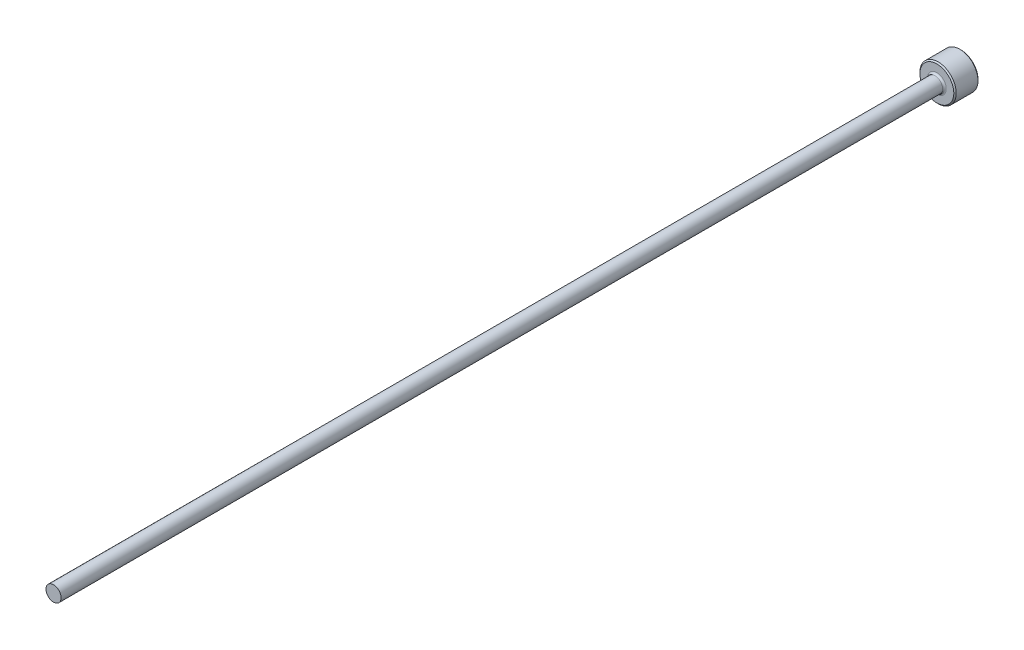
SolidWorks part; units mm, degrees
ref_plane "Front Plane" through (0, 0, 0) normal (0, 0, 1) x (1, 0, 0)
ref_plane "Top Plane" through (0, 0, 0) normal (0, 1, 0) x (1, 0, 0)
ref_plane "Right Plane" through (0, 0, 0) normal (1, 0, 0) x (0, 0, -1)
sketch "Sketch1" plane through (0, 0, 0) normal (1, 0, 0) x (0, 0, -1)
  line L0 (0, 0) -> (0, 3)
  line L1 (0, 3.3) -> (0, -3.3) construction
  line L2 (0, 3) -> (-4, 3)
  line L3 (-4, 3) -> (-4, 1.55)
  line L4 (-4.3, 1.25) -> (-150, 1.25)
  line L5 (-150, 1.25) -> (-150, 0)
  line L6 (3.3, 0) -> (-3.3, 0) construction
  line L7 (-150, 0) -> (0, 0)
  line L8 (-109.0506, 0) -> (16.9928, 0) construction
  arc A0 (-4, 1.55) -> (-4.3, 1.25) centre (-4.3, 1.55) cw
  dimension "D1" = 0.3
  dimension "D2" = 6
  dimension "D3" = 2.5
  dimension "D4" = 150
  dimension "D5" = 4
revolve "Revolve1" add sketch "Sketch1" angle 360 about L8
chamfer "Chamfer1" distance 0.2 angle 45 2 edges at (3, 0, 0) (3, 0, 4)
